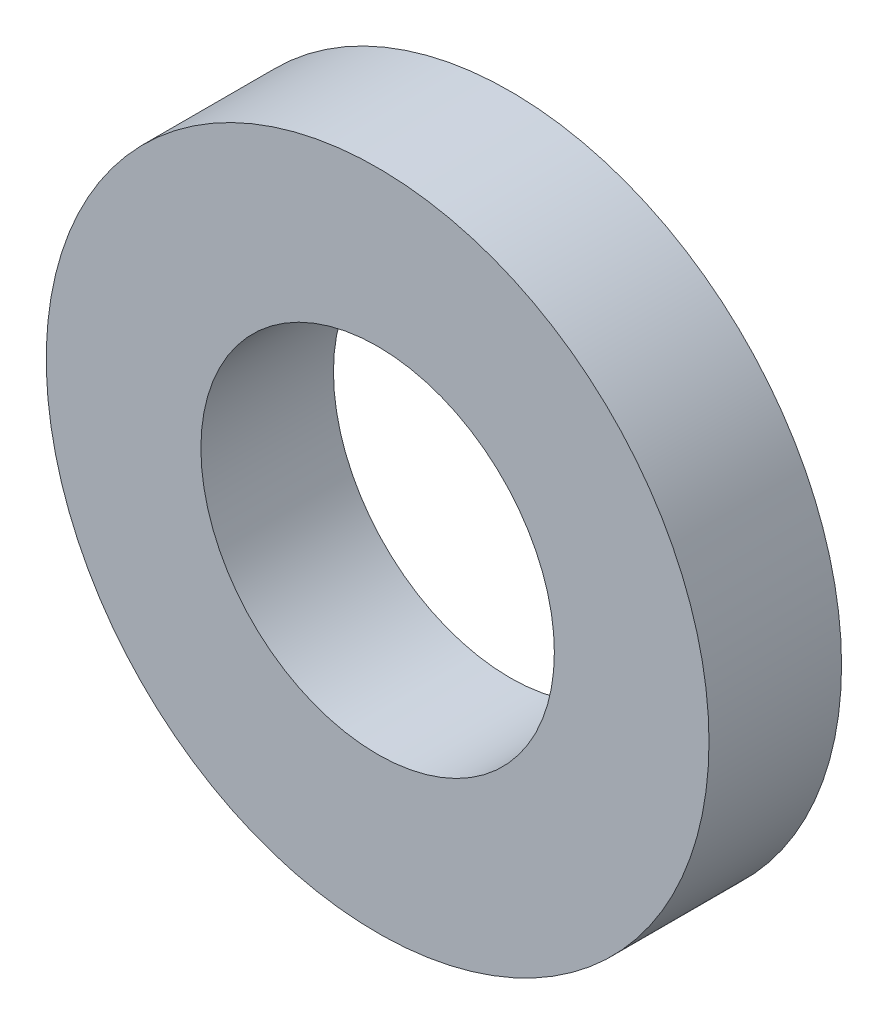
SolidWorks part; units mm, degrees
ref_plane "Alzado" through (0, 0, 0) normal (0, 0, 1) x (1, 0, 0)
ref_plane "Planta" through (0, 0, 0) normal (0, 1, 0) x (1, 0, 0)
ref_plane "Vista lateral" through (0, 0, 0) normal (1, 0, 0) x (0, 0, -1)
sketch "Croquis1" plane through (0, 0, 0) normal (0, 0, 1) x (1, 0, 0)
  circle A0 centre (0, 0) radius 4
  circle A1 centre (0, 0) radius 7.5
  dimension "D1" = 8
  dimension "D2" = 15
extrude "Saliente-Extruir1" add sketch "Croquis1" along normal mid plane 3
